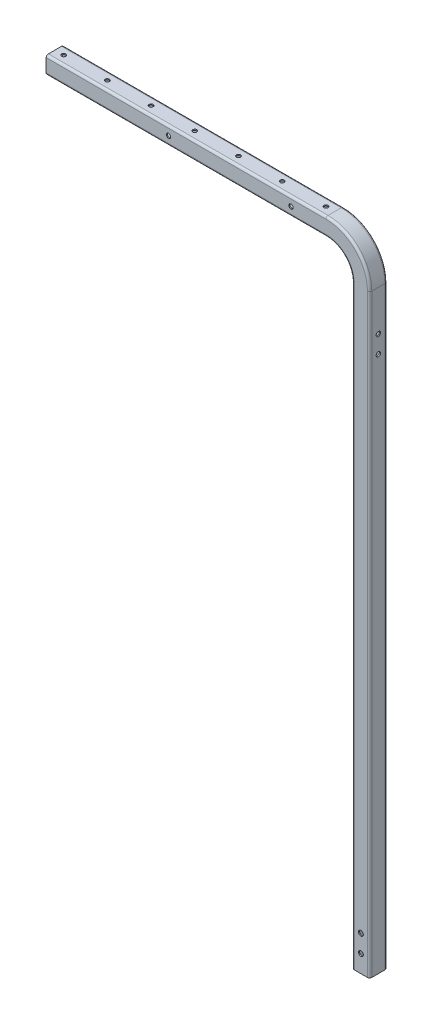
SolidWorks part; units mm, degrees
ref_plane "Front" through (0, 0, 0) normal (0, 0, 1) x (1, 0, 0)
ref_plane "Top" through (0, 0, 0) normal (0, 1, 0) x (1, 0, 0)
ref_plane "Right" through (0, 0, 0) normal (1, 0, 0) x (0, 0, -1)
sketch "Sketch1" plane through (0, 0, 0) normal (0, 0, 1) x (1, 0, 0)
  line L0 (0, 0) -> (406.4, 0)
  line L1 (457.2, -50.8) -> (457.2, -914.4)
  arc A0 (457.2, -50.8) -> (406.4, 0) centre (406.4, -50.8) ccw
  dimension "D1" = 50.8
  dimension "D2" = 457.2
  dimension "D3" = 914.4
sketch "Sketch2"
  line L0 (-12.7, 12.7) -> (12.7, 12.7)
  line L1 (-12.7, 12.7) -> (-12.7, -12.7)
  line L2 (12.7, -12.7) -> (-12.7, -12.7)
  line L3 (12.7, -12.7) -> (12.7, 12.7)
  line L4 (12.7, 12.7) -> (-12.7, -12.7) construction
  dimension "square" = 25.4
sweep "Base-Sweep" add profiles "Sketch2" path "Sketch1"
fillet "Fillet1" radius 3.175 12 edges at (451.3013, -5.8987, 12.7) (451.3013, -5.8987, -12.7) (433.3408, -23.8592, -12.7) (433.3408, -23.8592, 12.7) (469.9, -482.6, 12.7) (469.9, -482.6, -12.7) (444.5, -482.6, -12.7) (444.5, -482.6, 12.7) (203.2, 12.7, 12.7) (203.2, 12.7, -12.7) (203.2, -12.7, -12.7) (203.2, -12.7, 12.7)
shell "Shell1" thickness 1.5875
hole_wizard "Ø6.0 (6) Diameter Hole1" positions "Sketch9" profile "Sketch10" hole size "Ø6.0" standard "ANSI Metric"
sketch "Sketch9" plane through (0, 12.7, 0) normal (0, 1, 0) x (1, 0, 0)
  line L0 (393.7, 0) -> (406.4, 0) construction
  line L1 (406.4, -9.525) -> (406.4, 9.525) construction
  point P0 (393.7, 0)
  dimension "D1" = 12.7
sketch "Sketch10" plane through (393.7, 12.7, 0) normal (1, 0, 0) x (0, 0, 1)
  line L0 (0, 0) -> (0, 927.1)
  line L1 (0, 927.1) -> (3, 927.1)
  line L2 (3, 927.1) -> (3, 0)
  line L5 (3, 0) -> (0, 0)
  line L11 (0, -6.35) -> (0, 107.95) construction
  dimension "Thru Hole Dia." = 6
  dimension "Thru Hole Depth" = 927.1
pattern_linear "LPattern3" count 7 spacing 63.5 along (-1, 0, 0) of "Ø6.0 (6) Diameter Hole1"
sketch "Sketch5" plane through (469.9, 0, 0) normal (1, 0, 0) x (0, 0, -1)
  line L4 (-9.525, 12.7) -> (9.525, 12.7) construction
  line L5 (0, 50) -> (0, -50) construction
  circle A4 centre (0, -109.5375) radius 3.175
  circle A5 centre (0, -134.9375) radius 3.175
  dimension "D1" = 122.2375
  dimension "D3" = 6.35
  dimension "D2" = 25.4
extrude "cont_mtg" cut sketch "Sketch5" against normal through all
hole_wizard "1/4 (0.25) Diameter Hole1" positions "Sketch7" profile "Sketch6" hole size "1/4" standard "Ansi Inch"
sketch "Sketch7" plane through (0, 0, 12.7) normal (0, 0, 1) x (1, 0, 0)
  line L1 (0, 9.525) -> (0, -9.525) construction
  line L2 (0, 0) -> (406.4, 0) construction
  point P0 (177.8, 0)
  point P1 (355.6, 0)
  dimension "D1" = 177.8
  dimension "D2" = 355.6
sketch "Sketch6" plane through (177.8, 0, 12.7) normal (1, 0, 0) x (0, -1, 0)
  line L0 (0, 0) -> (0, 25.4)
  line L1 (0, 25.4) -> (3.175, 25.4)
  line L2 (3.175, 25.4) -> (3.175, 0)
  line L5 (3.175, 0) -> (0, 0)
  line L11 (0, -6.35) -> (0, 107.95) construction
  dimension "Thru Hole Dia." = 6.35
  dimension "Thru Hole Depth" = 25.4
sketch "Sketch8" plane through (0, 0, -12.7) normal (0, 0, -1) x (-1, 0, 0)
  line L1 (-447.675, -914.4) -> (-466.725, -914.4) construction
  line L2 (-457.2, -50.8) -> (-457.2, -914.4) construction
  circle A1 centre (-457.2, -889) radius 3.5719
  dimension "D1" = 7.1437
  dimension "D3" = 25.4
extrude "Cut-Extrude1" cut sketch "Sketch8" against normal through all
pattern_linear "LPattern2" count 2 spacing 25.4 along (0, 1, 0) of "Cut-Extrude1"
